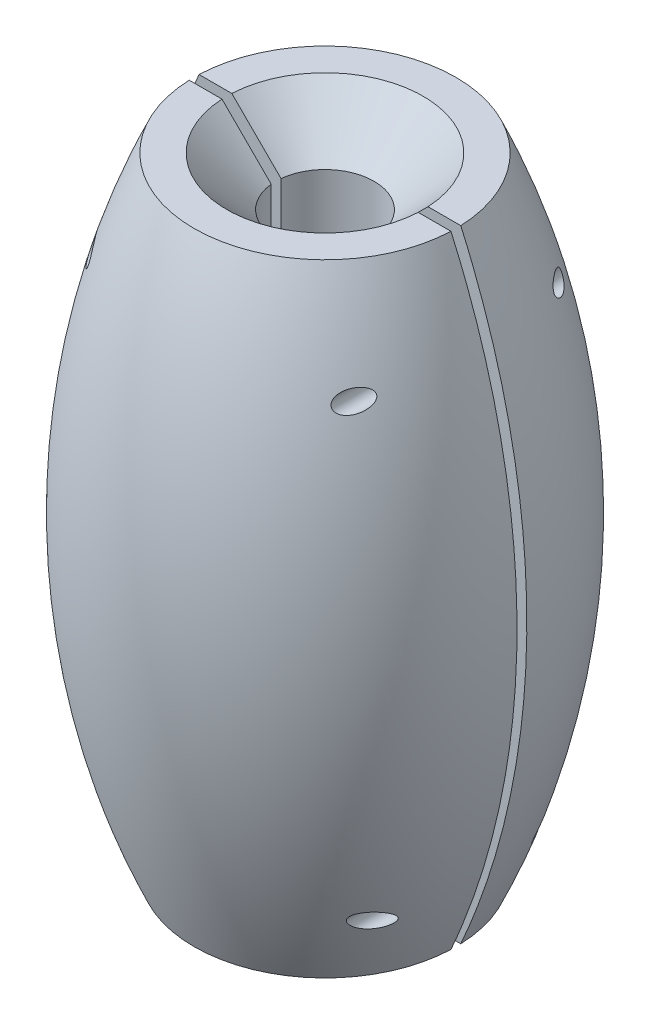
SolidWorks part; units mm, degrees
ref_plane "Front Plane" through (0, 0, 0) normal (0, 0, 1) x (1, 0, 0)
ref_plane "Top Plane" through (0, 0, 0) normal (0, 1, 0) x (1, 0, 0)
ref_plane "Right Plane" through (0, 0, 0) normal (1, 0, 0) x (0, 0, -1)
sketch "Sketch1" plane through (0, 0, 0) normal (0, 0, 1) x (1, 0, 0)
  line L0 (0, 254) -> (0, -228.6)
  line L1 (0, 254) -> (101.6, 254)
  line L2 (0, -228.6) -> (101.6, -228.6)
  line L3 (0, 430.3715) -> (0, -403.9559) construction
  arc A0 (101.6, 254) -> (101.6, -228.6) centre (-440.8796, 12.7) cw
  dimension "D4" = 101.6
  dimension "D6" = 228.6
  dimension "D5" = 101.6
  dimension "D2" = 593.7254
  dimension "D1" = 254
revolve "Revolve1" add sketch "Sketch1" angle 360 about L3
sketch "Sketch2" plane through (0, -228.6, 0) normal (0, -1, 0) x (1, 0, 0)
  line L0 (37.909, 3.81) -> (200.5928, 3.81)
  line L1 (-182.0556, 3.81) -> (-37.909, 3.81)
  line L2 (-182.0556, 3.81) -> (-182.0556, -3.81)
  line L3 (-182.0556, -3.81) -> (-37.909, -3.81)
  line L4 (200.5928, 3.81) -> (200.5928, -3.81)
  line L5 (37.909, -3.81) -> (200.5928, -3.81)
  arc A0 (-37.909, -3.81) -> (37.909, -3.81) centre (0, 0) ccw
  arc A1 (37.909, 3.81) -> (-37.909, 3.81) centre (0, 0) ccw
  dimension "D1" = 76.2
  dimension "D2" = 7.62
  dimension "D3" = 3.81
extrude "Cut-Extrude1" cut sketch "Sketch2" against normal through all
sketch "Sketch3" plane through (0, 0, 0) normal (0, 0, 1) x (1, 0, 0)
  line L0 (0, 0) -> (0, 44.5614)
  circle A0 centre (-101.6, 177.8) radius 7.62
  circle A1 centre (-101.6, -177.8) radius 7.62
  circle A2 centre (101.6, -177.8) radius 7.62
  circle A3 centre (101.6, 177.8) radius 7.62
  dimension "D5" = 15.24
  dimension "D6" = 15.24
  dimension "D1" = 177.8
  dimension "D2" = 177.8
  dimension "D3" = 101.6
  dimension "D4" = 101.6
extrude "Cut-Extrude2" cut sketch "Sketch3" against normal through all and the other way through all contours A0 | A3 | A2 | A1
chamfer "Chamfer1" distance 38.1 angle 45 2 edges at (0, 254, 38.1) (0, -228.6, 38.1)
chamfer "Chamfer2" distance 38.1 angle 45 2 edges at (0, 254, -38.1) (0, -228.6, -38.1)
sketch "Sketch4" plane through (0, 0, 3.81) normal (0, 0, -1) x (-1, 0, 0)
  circle A0 centre (-101.6, 177.8) radius 7.62
  circle A1 centre (101.6, 177.8) radius 7.62
  circle A2 centre (-101.6, -177.8) radius 7.62
  circle A3 centre (101.6, -177.8) radius 7.62
extrude "Cut-Extrude3" cut sketch "Sketch4" against normal through all
